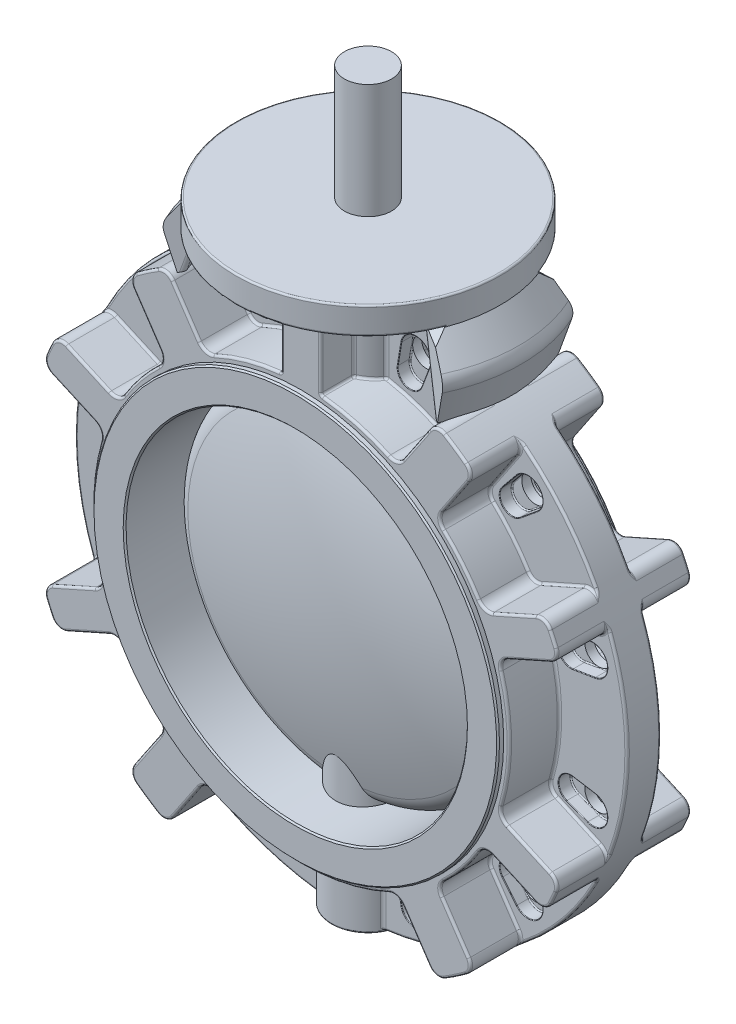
SolidWorks part; units mm, degrees
ref_plane "Front Plane" through (0, 0, 0) normal (0, 0, 1) x (1, 0, 0)
ref_plane "Top Plane" through (0, 0, 0) normal (0, 1, 0) x (1, 0, 0)
ref_plane "Right Plane" through (0, 0, 0) normal (1, 0, 0) x (0, 0, -1)
sketch "Sketch1" plane through (0, 0, 0) normal (0, 0, 1) x (1, 0, 0)
  circle A0 centre (0, 0) radius 245
  circle A1 centre (0, 0) radius 158.5
  dimension "D1" = 490
  dimension "D2" = 317
extrude "Extrude1" add sketch "Sketch1" along normal mid plane 119
sketch "Sketch2" plane through (0, 0, 0) normal (0, 0, 1) x (1, 0, 0)
  circle A0 centre (0, 0) radius 158.5 construction
  circle A1 centre (0, 0) radius 158.5
sketch "Sketch3" plane through (0, 0, 0) normal (0, 0, 1) x (1, 0, 0)
  line L0 (0, 0) -> (0, 257.0196) construction
  line L1 (0, 0) -> (-301.2022, 0) construction
  line L2 (0, 0) -> (-67.6779, 252.5775) construction
  circle A0 centre (0, 0) radius 216 construction
  circle A1 centre (-55.9049, 208.64) radius 12.25
  circle A2 centre (55.9049, 208.64) radius 12.25
  circle A3 centre (152.7351, 152.7351) radius 12.25
  circle A4 centre (208.64, 55.9049) radius 12.25
  circle A5 centre (208.64, -55.9049) radius 12.25
  circle A6 centre (152.7351, -152.7351) radius 12.25
  circle A7 centre (55.9049, -208.64) radius 12.25
  circle A8 centre (-55.9049, -208.64) radius 12.25
  circle A9 centre (-152.7351, -152.7351) radius 12.25
  circle A10 centre (-208.64, -55.9049) radius 12.25
  circle A11 centre (-208.64, 55.9049) radius 12.25
  circle A12 centre (-152.7351, 152.7351) radius 12.25
  dimension "D1" = 432
  dimension "D3" = 24.5
  dimension "D2" = 15
extrude "Cut-Extrude1" cut sketch "Sketch3" against normal through all and the other way through all
sketch "Sketch5" plane through (0, 0, 59.5) normal (0, 0, 1) x (1, 0, 0)
  line L0 (0, 0) -> (-280.5902, 0) construction
  line L1 (0, 0) -> (0, 50.9382) construction
  line L2 (-259.8831, 115.7074) -> (278.1806, -123.854) construction
  line L3 (-253.2624, -112.7597) -> (304.8105, 135.7104) construction
  line L4 (0, 0) -> (-155.7407, 230.8951) construction
  line L5 (0, 0) -> (-152.3809, -225.914) construction
  line L6 (-148.6761, 182.8672) -> (-125.0657, 147.8634)
  line L7 (-113.8565, 206.3533) -> (-90.2461, 171.3495)
  line L8 (-208.1054, 110.1687) -> (-170.043, 93.2222)
  line L9 (-221.121, 80.9352) -> (-183.0586, 63.9887)
  line L10 (-113.8565, -206.3533) -> (-85.3722, -164.1237)
  line L11 (-148.6761, -182.8672) -> (-125.0657, -147.8634)
  line L12 (-221.121, -80.9352) -> (-183.0586, -63.9887)
  line L13 (-208.1054, -110.1687) -> (-170.043, -93.2222)
  line L14 (113.8565, -206.3533) -> (85.3722, -164.1237)
  line L15 (148.6761, -182.8672) -> (125.0657, -147.8634)
  line L16 (208.1054, -110.1687) -> (170.043, -93.2222)
  line L17 (221.121, -80.9352) -> (183.0586, -63.9887)
  line L18 (221.121, 80.9352) -> (183.0586, 63.9887)
  line L19 (208.1054, 110.1687) -> (170.043, 93.2222)
  line L20 (148.6761, 182.8672) -> (125.0657, 147.8634)
  line L21 (113.8565, 206.3533) -> (90.2461, 171.3495)
  line L22 (0, 0) -> (15.6788, 7.7255) construction
  line L24 (0, 0) -> (159.012, 235.7449) construction
  line L25 (0, 0) -> (296.1627, 0) construction
  line L26 (0, 0) -> (15.6788, 15.6788) construction
  line L27 (0, 0) -> (155.8313, -231.0295) construction
  circle A2 centre (0, 0) radius 245 construction
  arc A3 (-226.2899, -93.9035) -> (-221.2014, -105.3325) centre (0, 0) ccw
  arc A4 (-177.5297, 52.0403) -> (-177.5297, -52.0403) centre (0, 0) ccw
  arc A5 (-221.2014, 105.3325) -> (-226.2899, 93.9035) centre (0, 0) ccw
  arc A6 (-146.3596, -196.4787) -> (-127.3446, -209.3044) centre (0, 0) ccw
  arc A7 (127.3446, -209.3044) -> (146.3596, -196.4787) centre (0, 0) ccw
  arc A8 (221.2014, -105.3325) -> (226.2899, -93.9035) centre (0, 0) ccw
  arc A9 (226.2899, 93.9035) -> (221.2014, 105.3325) centre (0, 0) ccw
  arc A10 (146.3596, 196.4787) -> (127.3446, 209.3044) centre (0, 0) ccw
  arc A11 (-127.3446, 209.3044) -> (-146.3596, 196.4787) centre (0, 0) ccw
  arc A12 (-126.5173, 134.9755) -> (-157.4641, 97.1085) centre (0, 0) ccw
  arc A13 (77.7529, 167.8675) -> (-77.7529, 167.8675) centre (0, 0) ccw
  arc A14 (157.4641, 97.1085) -> (126.5173, 134.9755) centre (0, 0) ccw
  arc A15 (177.5297, -52.0403) -> (177.5297, 52.0403) centre (0, 0) ccw
  arc A16 (126.5173, -134.9755) -> (157.4641, -97.1085) centre (0, 0) ccw
  arc A17 (-85.3722, -164.1237) -> (85.3722, -164.1237) centre (0, 0) ccw
  arc A18 (-157.4641, -97.1085) -> (-126.5173, -134.9755) centre (0, 0) ccw
  arc A19 (-146.3596, 196.4787) -> (-148.6761, 182.8672) centre (-140.3857, 188.4592) ccw
  arc A20 (-113.8565, 206.3533) -> (-127.3446, 209.3044) centre (-122.1469, 200.7614) ccw
  arc A21 (-208.1054, 110.1687) -> (-221.2014, 105.3325) centre (-212.1728, 101.0332) ccw
  arc A22 (-221.121, 80.9352) -> (-226.2899, 93.9035) centre (-217.0536, 90.0707) cw
  arc A23 (127.3446, 209.3044) -> (113.8565, 206.3533) centre (122.1469, 200.7614) ccw
  arc A24 (148.6761, 182.8672) -> (146.3596, 196.4787) centre (140.3857, 188.4592) ccw
  arc A25 (221.2014, 105.3325) -> (208.1054, 110.1687) centre (212.1728, 101.0332) ccw
  arc A26 (221.121, 80.9352) -> (226.2899, 93.9035) centre (217.0536, 90.0707) ccw
  arc A27 (226.2899, -93.9035) -> (221.121, -80.9352) centre (217.0536, -90.0707) ccw
  arc A28 (208.1054, -110.1687) -> (221.2014, -105.3325) centre (212.1728, -101.0332) ccw
  arc A29 (146.3596, -196.4787) -> (148.6761, -182.8672) centre (140.3857, -188.4592) ccw
  arc A30 (113.8565, -206.3533) -> (127.3446, -209.3044) centre (122.1469, -200.7614) ccw
  arc A31 (-127.3446, -209.3044) -> (-113.8565, -206.3533) centre (-122.1469, -200.7614) ccw
  arc A32 (-148.6761, -182.8672) -> (-146.3596, -196.4787) centre (-140.3857, -188.4592) ccw
  arc A33 (-221.2014, -105.3325) -> (-208.1054, -110.1687) centre (-212.1728, -101.0332) ccw
  arc A34 (-221.121, -80.9352) -> (-226.2899, -93.9035) centre (-217.0536, -90.0707) ccw
  arc A35 (-126.5173, 134.9755) -> (-125.0657, 147.8634) centre (-133.3561, 142.2714) ccw
  arc A36 (-77.7529, 167.8675) -> (-90.2461, 171.3495) centre (-81.9557, 176.9414) cw
  arc A37 (90.2461, 171.3495) -> (77.7529, 167.8675) centre (81.9557, 176.9414) cw
  arc A38 (126.5173, 134.9755) -> (125.0657, 147.8634) centre (133.3561, 142.2714) cw
  arc A39 (157.4641, 97.1085) -> (170.043, 93.2222) centre (165.9756, 102.3577) ccw
  arc A40 (177.5297, 52.0403) -> (183.0586, 63.9887) centre (187.1259, 54.8533) cw
  arc A41 (183.0586, -63.9887) -> (177.5297, -52.0403) centre (187.1259, -54.8533) cw
  arc A42 (157.4641, -97.1085) -> (170.043, -93.2222) centre (165.9756, -102.3577) cw
  arc A43 (125.0657, -147.8634) -> (126.5173, -134.9755) centre (133.3561, -142.2714) cw
  arc A44 (-157.4641, 97.1085) -> (-170.043, 93.2222) centre (-165.9756, 102.3577) cw
  arc A45 (-177.5297, 52.0403) -> (-183.0586, 63.9887) centre (-187.1259, 54.8533) ccw
  arc A46 (-183.0586, -63.9887) -> (-177.5297, -52.0403) centre (-187.1259, -54.8533) ccw
  arc A47 (-157.4641, -97.1085) -> (-170.043, -93.2222) centre (-165.9756, -102.3577) ccw
  arc A48 (-125.0657, -147.8634) -> (-126.5173, -134.9755) centre (-133.3561, -142.2714) ccw
  point P24 (-153.9078, 190.6236)
  point P32 (-119.0883, 214.1097)
  point P45 (-216.8331, 114.0545)
  point P55 (-229.8486, 84.821)
  point P58 (119.0883, 214.1097)
  point P61 (153.9078, 190.6236)
  point P64 (216.8331, 114.0545)
  point P67 (229.8486, 84.821)
  point P70 (229.8486, -84.821)
  point P73 (216.8331, -114.0545)
  point P76 (153.9078, -190.6236)
  point P79 (119.0883, -214.1097)
  point P82 (-119.0883, -214.1097)
  point P85 (-153.9078, -190.6236)
  point P88 (-216.8331, -114.0545)
  point P91 (-229.8486, -84.821)
  point P110 (174.8804, -60.3476)
  point P113 (161.8649, -89.5811)
  point P124 (-174.8804, -60.3476)
  point P127 (-161.8649, -89.5811)
  dimension "D2" = 56
  dimension "D3" = 56
  dimension "D1" = 370
  dimension "D8" = 10
  dimension "D9" = 10
  dimension "D13" = 10
  dimension "D14" = 10
  dimension "D4" = 56
  dimension "D5" = 56
  dimension "D6" = 32
  dimension "D7" = 42
extrude "Cut-Extrude3" cut sketch "Sketch5" against normal blind 44.5 flip side to cut
mirror "Mirror1" about plane through (0, 0, 0) normal (0, 0, 1) of "Cut-Extrude3"
fillet "Fillet1" radius 10 4 edges at (85.3722, -164.1237, 37.25) (-85.3722, -164.1237, 37.25) (-85.3722, -164.1237, -37.25) (85.3722, -164.1237, -37.25)
ref_plane "Plane1" through (0, 298, 0) normal (0, 1, 0) x (-1, 0, 0)
ref_plane "Plane2" through (0, 274, 0) normal (0, 1, 0) x (-1, 0, 0)
ref_plane "Plane4" through (75, 0, 0) normal (1, 0, 0) x (0, 0, -1)
sketch "Sketch6" plane through (0, 274, 0) normal (0, 1, 0) x (-1, 0, 0)
  line L0 (0, 0) -> (0, -133.2606) construction
  line L1 (127.3446, 15) -> (-127.3446, 15) construction
  line L2 (-127.3446, -15) -> (127.3446, -15) construction
  line L3 (115, 15) -> (-115, 15)
  line L4 (-115, -15) -> (115, -15)
  line L5 (115, -15) -> (115, 15)
  line L6 (-115, -15) -> (-115, 15)
  dimension "D1" = 230
extrude "Extrude3" add sketch "Sketch6" against normal up to surface (57.6669 mm away)
sketch "Sketch7" plane through (0, 298, 0) normal (0, 1, 0) x (-1, 0, 0)
  circle A0 centre (0, 0) radius 117.5
  dimension "D1" = 235
extrude "Extrude4" add sketch "Sketch7" against normal up to surface (24 mm away)
chamfer "Chamfer1" distance 8 angle 45 2 edges at (158.5, 0, -59.5) (158.5, 0, 59.5)
sketch "Sketch8" plane through (0, 0, 0) normal (0, 0, 1) x (1, 0, 0)
  line L0 (-117.5, 274) -> (117.5, 274) construction
  line L1 (102.3279, 274) -> (117.5, 274)
  line L2 (102.3279, 274) -> (122.1469, 210.7614)
  line L4 (117.5, 274) -> (138.3248, 245.0333)
  line L5 (127.3446, 209.3044) -> (138.3248, 245.0333)
  arc A0 (127.3446, 209.3044) -> (113.8565, 206.3533) centre (122.1469, 200.7614) ccw construction
  arc A1 (127.3446, 209.3044) -> (122.1469, 210.7614) centre (122.1469, 200.7614) ccw
revolve "Revolve1" add sketch "Sketch8" angle 50 about axis through (0, -58.3402, 0) along (0, 1, 0)
fillet "Fillet2" radius 15 1 edges at (138.3248, 245.0333, 0)
mirror "Mirror2" about plane through (0, 0, 0) normal (1, 0, 0) of "Fillet2", "Revolve1"
ref_plane "Plane3" through (0, -245, 0) normal (0, 1, 0) x (-1, 0, 0)
sketch "Sketch9" plane through (0, -245, 0) normal (0, 1, 0) x (-1, 0, 0)
  circle A0 centre (0, 0) radius 32.5
  dimension "D1" = 65
extrude "Extrude5" add sketch "Sketch9" along normal up to surface (60 mm away)
sketch "Sketch10" plane through (0, 274, 0) normal (0, 1, 0) x (-1, 0, 0)
  line L0 (77.7529, 59.5) -> (-77.7529, 59.5) construction
  line L1 (-77.7529, -59.5) -> (77.7529, -59.5) construction
  line L2 (17.5, 59.5) -> (-17.5, 59.5)
  line L3 (-17.5, -59.5) -> (17.5, -59.5)
  line L4 (17.5, -59.5) -> (17.5, -30.3109)
  line L5 (-17.5, -59.5) -> (-17.5, -30.3109)
  line L6 (0, 0) -> (0, -156.0214) construction
  line L7 (-17.5, 30.3109) -> (-17.5, 59.5)
  line L8 (17.5, 30.3109) -> (17.5, 59.5)
  arc A0 (-17.5, 30.3109) -> (-17.5, -30.3109) centre (0, 0) ccw
  arc A1 (17.5, -30.3109) -> (17.5, 30.3109) centre (0, 0) ccw
  dimension "D2" = 70
  dimension "D1" = 35
extrude "Extrude6" add sketch "Sketch10" against normal up to surface (89.8296 mm away)
sketch "Sketch11" plane through (75, 0, 0) normal (1, 0, 0) x (0, 0, -1)
  line L1 (-117.5, 274) -> (-49.6576, 274) construction
  line L2 (63.8928, 255.1684) -> (63.8928, 274)
  line L3 (-63.8928, 274) -> (-41.8262, 274)
  line L4 (-41.8262, 274) -> (-63.8928, 255.1684)
  line L5 (-63.8928, 255.1684) -> (-63.8928, 274)
  line L6 (0, 274) -> (0, 325.452) construction
  line L7 (0, 274) -> (0, 298) construction
  line L8 (49.6576, 274) -> (-49.6576, 274) construction
  line L9 (41.8262, 274) -> (63.8928, 255.1684)
  line L10 (63.8928, 274) -> (41.8262, 274)
  line L11 (129.25, 274) -> (-129.25, 274) construction
extrude "Cut-Extrude4" cut sketch "Sketch11" along normal through all
sketch "Sketch12" plane through (0, 0, 15) normal (0, 0, 1) x (1, 0, 0)
  line L0 (0, 0) -> (156.2706, 156.2706) construction
  line L1 (0, 0) -> (0, 317.6373) construction
  line L2 (134.3186, 149.7969) -> (146.9122, 165.2048)
  line L3 (149.7969, 134.3186) -> (165.2048, 146.9122)
  arc A0 (134.3186, 149.7969) -> (149.7969, 134.3186) centre (142.8356, 142.8356) ccw
  arc A1 (165.2048, 146.9122) -> (146.9122, 165.2048) centre (156.9777, 156.9777) ccw
  arc A6 (221.2014, 105.3325) -> (146.3596, 196.4787) centre (0, 0) ccw construction
  point P2 (166.1701, 166.1701)
  dimension "D2" = 26
  dimension "D3" = 22
  dimension "D4" = 10
  dimension "D5" = 1
  dimension "D6" = 44
  dimension "D1" = 45
extrude "Cut-Extrude5" cut sketch "Sketch12" against normal blind 11 and the other way through all
pattern_circular "CirPattern1" count 12 over 360 about axis through (0, 0, 0) along (0, 0, 1) of "Cut-Extrude5"
mirror "Mirror3" about plane through (0, 0, 0) normal (0, 0, 1) of "CirPattern1", "Cut-Extrude5"
fillet "Fillet4" radius 3.5 24 edges at (-101.7216, 242.3807, 47.4336) (-101.7216, 242.3807, -47.4336) (3.9002, -184.9589, 32.2651) (28.8314, -213.0186, 15) (28.8314, -213.0186, -15) (-28.8314, -213.0186, 15) (-28.8314, -213.0186, -15) (3.9002, -184.9589, 32.2651) (-31.6228, 228.1386, 15) (-28.237, 182.8324, 20.6803) (-17.5, 229.0852, 30.3109) (26.5709, 183.0819, 22.7813) (31.6228, 228.1386, 15) (-17.5, 229.0852, -30.3109) (-26.5709, 183.0819, -22.7813) (-31.6228, 228.1386, -15) (17.5, 229.0852, 30.3109) (31.6228, 228.1386, -15) (28.237, 182.8324, -20.6803) (17.5, 229.0852, -30.3109) (101.9156, 241.6979, -47.524) (93.2621, 273.3167, -42.6269) (101.9156, 241.6979, 47.524) (93.2621, 273.3167, 42.6269)
mirror "Mirror5" about plane through (0, 0, 0) normal (1, 0, 0) of "Cut-Extrude4"
fillet "Fillet5" radius 1.5 4 edges at (0, 298, 117.5) (0, 274, 117.5) (0, 274, -117.5) (0, -245, 32.5)
fillet "Fillet6" radius 2 196 edges at (215.637, 110.414, 15) (189.0742, 101.6954, 15) (163.0237, 92.8033, 15) (143.2474, 117.0691, 15) (123.4189, 141.1522, 15) (136.8709, 165.3653, 15) (150.244, 190.1369, 15) (102.0513, 188.8514, 15) (84.6405, 167.3085, 15) (56.1976, 176.2578, 15) (-84.6405, 167.3085, 15) (-102.0513, 188.8514, 15) (-117.25, 209.4804, 15) (-150.244, 190.1369, 15) (-136.8709, 165.3653, 15) (-123.4189, 141.1522, 15) (-143.2474, 117.0691, 15) (-163.0237, 92.8033, 15) (-189.0742, 101.6954, 15) (-215.637, 110.414, 15) (-226.3429, 86.3681, 15) (-202.0898, 72.462, 15) (-178.0504, 59.0527, 15) (-185, 0, 15) (-178.0504, -59.0527, 15) (55.4005, -176.51, -15) (-202.0898, -72.462, 15) (-226.3429, -86.3681, 15) (0, -185, -36) (-80.8925, -231.2605, -15) (-215.637, -110.414, 15) (55.4005, -176.51, 15) (4.3127, -184.9497, 35.7308) (80.8925, -231.2605, 15) (-189.0742, -101.6954, 15) (-163.0237, -92.8033, 15) (-26.5709, 183.0819, -22.7813) (-143.2474, -117.0691, 15) (-25.6673, 274, -23.7947) (25.6673, 274, -23.7947) (17.5, 274, -45.8842) (-123.4189, -141.1522, 15) (-67.4932, 274, -15) (31.9801, 274, -15.4887) (17.9233, 274, -30.5998) (-17.9233, 274, -30.5998) (-31.9801, 274, -15.4887) (-136.8709, -165.3653, 15) (-56.1976, 176.2578, -15) (-18.2286, 184.0997, -30.1307) (-31.5517, 182.2896, -15.7878) (-150.244, -190.1369, 15) (17.5, 184.1704, -45.8842) (32.4109, 182.1388, -15.2721) (-120.0095, -210.5303, 15) (17.6959, 184.1517, -31.114) (-102.0513, -188.8514, 15) (-25.6673, 274, 23.7947) (-17.5, 274, 45.8842) (25.6673, 274, 23.7947) (67.4932, 274, 15) (-31.9801, 274, 15.4887) (31.9801, 274, 15.4887) (-17.9233, 274, 30.5998) (17.9233, 274, 30.5998) (26.5709, 183.0819, 22.7813) (120.0095, -210.5303, 15) (31.5517, 182.2896, 15.7878) (18.2286, 184.0997, 30.1307) (150.244, -190.1369, 15) (-17.5, 184.1704, 45.8842) (-56.1976, 176.2578, 15) (-32.4109, 182.1388, 15.2721) (-17.6959, 184.1517, 31.114) (136.8709, -165.3653, 15) (123.4189, -141.1522, 15) (28.6452, -243.3196, -15.8087) (-29.7183, -243.1909, -15.1994) (29.7183, -243.1909, 15.1994) (-28.6452, -243.3196, 15.8087) (143.2474, -117.0691, 15) (163.0237, -92.8033, 15) (189.0742, -101.6954, 15) (215.637, -110.414, 15) (226.3429, -86.3681, 15) (202.0898, -72.462, 15) (-29.7192, -183.4264, -15.1991) (29.7192, -183.4264, -15.1991) (178.0504, -59.0527, 15) (185, 0, 15) (29.7192, -183.4264, 15.1991) (-29.7192, -183.4264, 15.1991) (178.0504, 59.0527, 15) (202.0898, 72.462, 15) (226.3429, 86.3681, 15) (189.3467, 155.4761, 15) (-189.3467, 155.4761, 15) (-245, 0, 15) (-189.3467, -155.4761, 15) (-80.8925, -231.2605, 15) (189.3467, -155.4761, 15) (245, 0, 15) (189.3467, 155.4761, -15) (245, 0, -15) (189.3467, -155.4761, -15) (80.8925, -231.2605, -15) (-189.3467, -155.4761, -15) (-245, 0, -15) (-189.3467, 155.4761, -15) (-150.244, 190.1369, -15) (-136.8709, 165.3653, -15) (-123.4189, 141.1522, -15) (-143.2474, 117.0691, -15) (-163.0237, 92.8033, -15) (-189.0742, 101.6954, -15) (-215.637, 110.414, -15) (-226.3429, 86.3681, -15) (-202.0898, 72.462, -15) (-178.0504, 59.0527, -15) (-185, 0, -15) (-178.0504, -59.0527, -15) (-202.0898, -72.462, -15) (-226.3429, -86.3681, -15) (-215.637, -110.414, -15) (-189.0742, -101.6954, -15) (-163.0237, -92.8033, -15) (-143.2474, -117.0691, -15) (-123.4189, -141.1522, -15) (-136.8709, -165.3653, -15) (-150.244, -190.1369, -15) (-120.0095, -210.5303, -15) (-102.0513, -188.8514, -15) (120.0095, -210.5303, -15) (150.244, -190.1369, -15) (136.8709, -165.3653, -15) (123.4189, -141.1522, -15) (143.2474, -117.0691, -15) (163.0237, -92.8033, -15) (189.0742, -101.6954, -15) (215.637, -110.414, -15) (226.3429, -86.3681, -15) (202.0898, -72.462, -15) (178.0504, -59.0527, -15) (185, 0, -15) (178.0504, 59.0527, -15) (202.0898, 72.462, -15) (226.3429, 86.3681, -15) (215.637, 110.414, -15) (189.0742, 101.6954, -15) (163.0237, 92.8033, -15) (143.2474, 117.0691, -15) (123.4189, 141.1522, -15) (136.8709, 165.3653, -15) (150.244, 190.1369, -15) (102.0513, 188.8514, -15) (84.6405, 167.3085, -15) (56.1976, 176.2578, -15) (-84.6405, 167.3085, -15) (-102.0513, 188.8514, -15) (-117.25, 209.4804, -15) (-55.4005, -176.51, -15) (102.0513, -188.8514, -15) (84.6405, -167.3085, -15) (-84.6405, -167.3085, -15) (-55.4005, -176.51, 15) (102.0513, -188.8514, 15) (-84.6405, -167.3085, 15) (84.6405, -167.3085, 15) (67.4932, 274, -15) (117.25, 209.4804, -15) (117.25, 209.4804, 15) (119.1617, 210.3054, -38.1909) (119.1617, 210.3054, 38.1909) (-67.4932, 274, 15) (-32.4999, -242.8348, 0.0986) (31.6816, -242.9429, -7.2475) (0, 274, 59.5) (17.5, 274, 45.8842) (0, 274, -59.5) (-17.5, 274, -45.8842) (-17.5, 184.1704, -45.8842) (17.5, 184.1704, 45.8842)
fillet "Fillet7" radius 2 47 edges at (143.2474, -117.0691, 59.5) (189.0742, -101.6954, 59.5) (178.0504, -59.0527, 59.5) (202.0898, 72.462, 59.5) (223.8186, 99.6505, 59.5) (178.0504, 59.0527, 59.5) (143.2474, 117.0691, 59.5) (123.4189, 141.1522, 59.5) (120.0095, 210.5303, 59.5) (102.0513, 188.8514, 59.5) (84.6405, 167.3085, 59.5) (49.1873, 178.3413, 59.5) (18.0139, 184.6421, 59.5) (-215.637, -110.414, 59.5) (-223.8186, -99.6505, 59.5) (-226.3429, -86.3681, 59.5) (-178.0504, -59.0527, 59.5) (-226.3429, 86.3681, 59.5) (-223.8186, 99.6505, 59.5) (-123.4189, 141.1522, 59.5) (-136.8709, 165.3653, 59.5) (-49.1873, 178.3413, 59.5) (-17.5, 228.9903, 59.5) (136.8709, -165.3653, 59.5) (-123.4189, -141.1522, 59.5) (18.0858, 273.4142, -60.0858) (143.2474, -117.0691, -59.5) (215.637, -110.414, -59.5) (223.8186, -99.6505, -59.5) (163.0237, 92.8033, -59.5) (123.4189, 141.1522, -59.5) (120.0095, 210.5303, -59.5) (-185, 0, -59.5) (-215.637, -110.414, -59.5) (-136.8709, -165.3653, -59.5) (-120.0095, -210.5303, -59.5) (-102.0513, -188.8514, -59.5) (102.0513, -188.8514, -59.5) (137.0023, -203.1142, -59.5) (150.244, -190.1369, -59.5) (136.8709, -165.3653, -59.5) (123.4189, -141.1522, -59.5) (-120.0095, 210.5303, -59.5) (-137.0023, 203.1142, -59.5) (-202.0898, 72.462, -59.5) (-84.6405, -167.3085, -59.5) (84.6405, -167.3085, -59.5)
fillet "Fillet10" radius 0.5 32 edges at (157.5009, 140.6154, 15) (166.1701, 166.1701, 15) (140.6154, 157.5009, 15) (135.0574, 135.0574, 15) (66.0921, 200.5269, 15) (60.8225, 226.9926, 15) (43.026, 206.7074, 15) (49.4344, 184.4918, 15) (-43.026, 206.7074, 15) (-60.8225, 226.9926, 15) (-66.0921, 200.5269, 15) (-49.4344, 184.4918, 15) (-66.0921, -200.5269, 15) (-60.8225, -226.9926, 15) (-43.026, -206.7074, 15) (-49.4344, -184.4918, 15) (43.026, -206.7074, 15) (60.8225, -226.9926, 15) (66.0921, -200.5269, 15) (49.4344, -184.4918, 15) (140.6154, -157.5009, 15) (166.1701, -166.1701, 15) (157.5009, -140.6154, 15) (135.0574, -135.0574, 15) (200.5269, -66.0921, 15) (226.9926, -60.8225, 15) (206.7074, -43.026, 15) (184.4918, -49.4344, 15) (206.7074, 43.026, 15) (226.9926, 60.8225, 15) (200.5269, 66.0921, 15) (184.4918, 49.4344, 15)
fillet "Fillet11" radius 1 93 edges at (-140.6154, 157.5009, 4) (-135.0574, 135.0574, 4) (-157.5009, 140.6154, 4) (-166.1701, 166.1701, 4) (200.5269, 66.0921, 4) (226.9926, 60.8225, 4) (206.7074, 43.026, 4) (166.1701, 166.1701, 4) (157.5009, 140.6154, 4) (135.0574, 135.0574, 4) (60.8225, 226.9926, 4) (66.0921, 200.5269, 4) (49.4344, 184.4918, 4) (-60.8225, 226.9926, 4) (-43.026, 206.7074, 4) (-49.4344, 184.4918, 4) (184.4918, 49.4344, 4) (140.6154, 157.5009, 4) (43.026, 206.7074, 4) (-66.0921, 200.5269, 4) (206.7074, -43.026, 4) (200.5269, -66.0921, 4) (157.5009, -140.6154, 4) (166.1701, -166.1701, 4) (140.6154, -157.5009, 4) (49.4344, -184.4918, 4) (66.0921, -200.5269, 4) (60.8225, -226.9926, 4) (-66.0921, -200.5269, 4) (-49.4344, -184.4918, 4) (-43.026, -206.7074, 4) (-157.5009, -140.6154, 4) (-135.0574, -135.0574, 4) (-140.6154, -157.5009, 4) (-206.7074, -43.026, 4) (-184.4918, -49.4344, 4) (-200.5269, -66.0921, 4) (-200.5269, 66.0921, 4) (-184.4918, 49.4344, 4) (-206.7074, 43.026, 4) (184.4918, -49.4344, 4) (135.0574, -135.0574, 4) (43.026, -206.7074, 4) (-60.8225, -226.9926, 4) (-166.1701, -166.1701, 4) (-226.9926, -60.8225, 4) (-226.9926, 60.8225, 4) (-43.026, 206.7074, -4) (-49.4344, 184.4918, -4) (-66.0921, 200.5269, -4) (-140.6154, 157.5009, -4) (-135.0574, 135.0574, -4) (-157.5009, 140.6154, -4) (-200.5269, 66.0921, -4) (-184.4918, 49.4344, -4) (-206.7074, 43.026, -4) (-206.7074, -43.026, -4) (-184.4918, -49.4344, -4) (-200.5269, -66.0921, -4) (-157.5009, -140.6154, -4) (-135.0574, -135.0574, -4) (-140.6154, -157.5009, -4) (-49.4344, -184.4918, -4) (-43.026, -206.7074, -4) (-60.8225, -226.9926, -4) (49.4344, -184.4918, -4) (66.0921, -200.5269, -4) (60.8225, -226.9926, -4) (157.5009, -140.6154, -4) (166.1701, -166.1701, -4) (140.6154, -157.5009, -4) (206.7074, -43.026, -4) (226.9926, -60.8225, -4) (200.5269, -66.0921, -4) (200.5269, 66.0921, -4) (226.9926, 60.8225, -4) (206.7074, 43.026, -4) (140.6154, 157.5009, -4) (166.1701, 166.1701, -4) (157.5009, 140.6154, -4) (66.0921, 200.5269, -4) (49.4344, 184.4918, -4) (-60.8225, 226.9926, -4) (-226.9926, 60.8225, -4) (-226.9926, -60.8225, -4) (-166.1701, -166.1701, -4) (-66.0921, -200.5269, -4) (43.026, -206.7074, -4) (135.0574, -135.0574, -4) (184.4918, -49.4344, -4) (184.4918, 49.4344, -4) (135.0574, 135.0574, -4) (43.026, 206.7074, -4)
sketch "Sketch13" plane through (0, 0, 0) normal (0, 0, 1) x (1, 0, 0)
  circle A0 centre (0, 0) radius 179.959
  circle A1 centre (0, 0) radius 151.511
  dimension "D1" = 359.918
  dimension "D2" = 303.022
extrude "Extrude7" add sketch "Sketch13" along normal mid plane 129.032
chamfer "Chamfer2" distance 1.27 angle 45 4 edges at (151.511, 0, -64.516) (179.959, 0, -64.516) (151.511, 0, 64.516) (179.959, 0, 64.516)
sketch "Sketch14" plane through (0, 0, 0) normal (0, 1, 0) x (1, 0, 0)
  circle A0 centre (0, 0) radius 28.575
  dimension "D1" = 57.15
extrude "Extrude8" add sketch "Sketch14" along normal mid plane 309.88
sketch "Sketch15" plane through (0, 0, 0) normal (0, 1, 0) x (1, 0, 0)
  line L0 (0, 0) -> (-252.8002, 0) construction
  line L1 (0, 0) -> (0, 132.5086) construction
  line L2 (-151.511, 3.2288) -> (-151.511, -3.2288)
  line L3 (0, 43.6983) -> (0, -43.6983)
  arc A0 (0, 43.6983) -> (-137.289, 22.6122) centre (0, -413.78) ccw
  arc A1 (0, -43.6983) -> (-137.289, -22.6122) centre (0, 413.78) cw
  arc A2 (-151.511, 3.2288) -> (-137.289, 22.6122) centre (-131.191, 3.2288) cw
  arc A3 (-137.289, -22.6122) -> (-151.511, -3.2288) centre (-131.191, -3.2288) cw
  point P12 (-151.511, 0)
  point P14 (-151.511, 17.8805)
  point P17 (-151.511, -17.8805)
  dimension "D2" = 20.32
  dimension "D1" = 151.511
revolve "Revolve2" add sketch "Sketch15" angle 360 about L1
sketch "Sketch16" plane through (0, 298, 0) normal (0, 1, 0) x (1, 0, 0)
  circle A0 centre (0, 0) radius 20.955
  dimension "D1" = 41.91
extrude "Extrude9" add sketch "Sketch16" along normal blind 101.6
